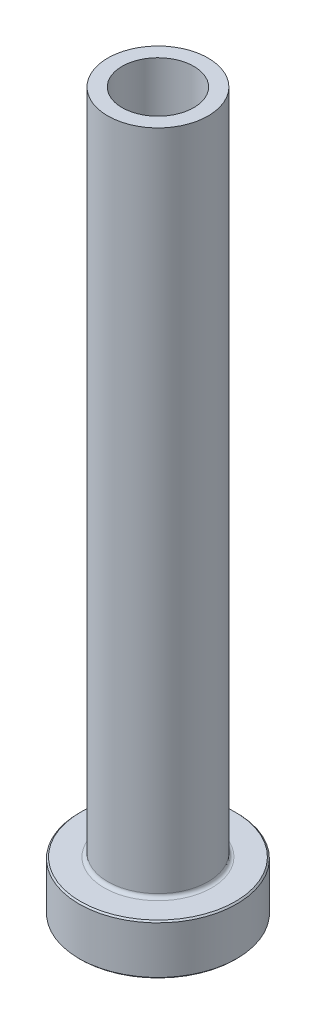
SolidWorks part; units mm, degrees
ref_plane "Front Plane" through (0, 0, 0) normal (0, 0, 1) x (1, 0, 0)
ref_plane "Top Plane" through (0, 0, 0) normal (0, 1, 0) x (1, 0, 0)
ref_plane "Right Plane" through (0, 0, 0) normal (1, 0, 0) x (0, 0, -1)
sketch "Sketch1" plane through (0, 0, 0) normal (0, 0, 1) x (1, 0, 0)
  line L0 (-5, 100) -> (-7, 100)
  line L1 (-7, 100) -> (-7, 7)
  line L2 (-7, 7) -> (-11, 7)
  line L3 (-11, 7) -> (-11, 0)
  line L4 (12.1, 0) -> (-12.1, 0) construction
  line L5 (-11, 0) -> (-5.25, 0)
  line L6 (-5, 55) -> (-5, 100)
  line L7 (0, 92.1877) -> (0, -15.5353) construction
  line L8 (0, -12.1) -> (0, 12.1) construction
  line L9 (-5, 55) -> (-5.25, 43)
  line L10 (-5.25, 43) -> (-5.25, 0)
  dimension "D1" = 0.25
  dimension "ID" = 10
  dimension "OD" = 14
  dimension "L" = 100
  dimension "H" = 22
  dimension "T" = 7
  dimension "N" = 45
  dimension "D2" = 12
revolve "Revolve1" add sketch "Sketch1" angle 360 about L7
fillet "Fillet1" radius 0.5 1 edges at (0, 7, 7)
chamfer "Chamfer1" distance 0.2 angle 45 2 edges at (0, 7, 11) (0, 0, 11)
chamfer "Chamfer3" distance 0.5 angle 45 1 edges at (0, 0, 5.25)
